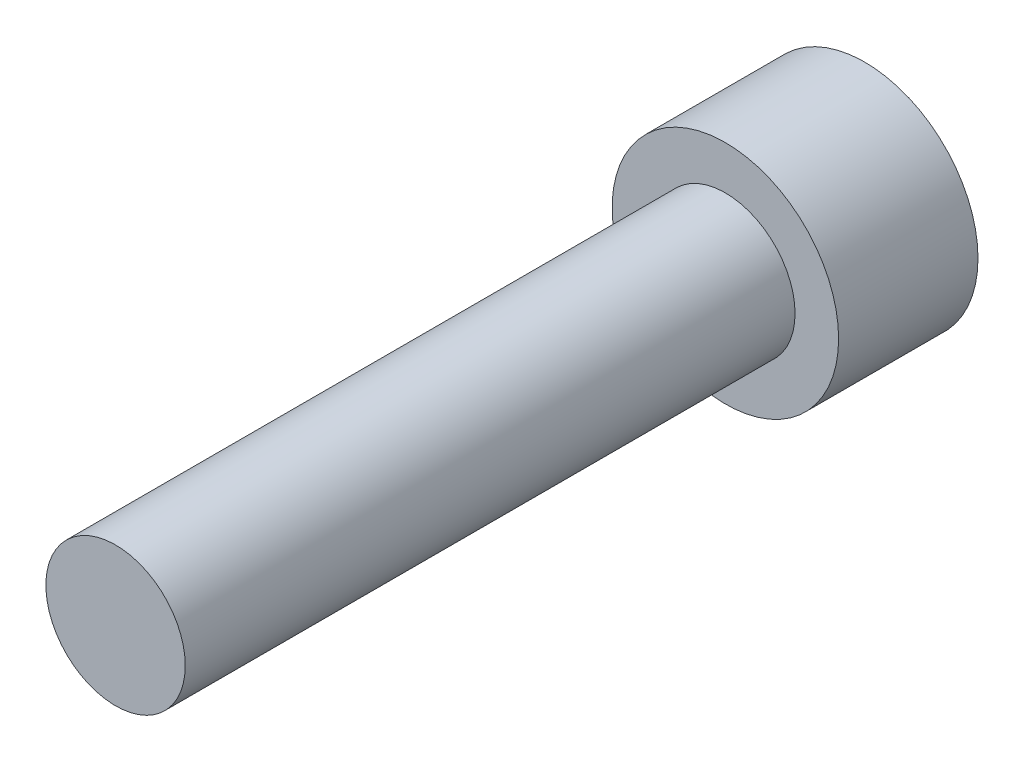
SolidWorks part; units mm, degrees
ref_plane "Front Plane" through (0, 0, 0) normal (0, 0, 1) x (1, 0, 0)
ref_plane "Top Plane" through (0, 0, 0) normal (0, 1, 0) x (1, 0, 0)
ref_plane "Right Plane" through (0, 0, 0) normal (1, 0, 0) x (0, 0, -1)
sketch "Sketch6" plane through (0, 0, 0) normal (1, 0, 0) x (0, 0, -1)
  line L0 (-35, 0) -> (22.525, 0) construction
  line L1 (7.15, 0) -> (-7.15, 0) construction
  line L2 (-35, 0) -> (-35, -4)
  line L3 (-35, -4) -> (0, -4)
  line L4 (0, 7.15) -> (0, -7.15) construction
  line L5 (0, -4) -> (0, -6.5)
  line L6 (0, -6.5) -> (8, -6.5)
  line L7 (8, -6.5) -> (8, 0)
  line L8 (8, 0) -> (-35, 0)
  dimension "L" = 35
  dimension "H" = 8
  dimension "A" = 13
  dimension "D" = 8
revolve "Revolve1" add sketch "Sketch6" angle 360 about L0
sketch "Sketch7" plane through (0, 0, -8) normal (0, 0, -1) x (-1, 0, 0)
  line L2 (-3, 1.7321) -> (-3, -1.7321)
  line L4 (-3, -1.7321) -> (0, -3.4641)
  line L5 (0, -3.4641) -> (3, -1.7321)
  line L6 (3, -1.7321) -> (3, 1.7321)
  line L7 (3, 1.7321) -> (0, 3.4641)
  line L8 (0, 3.4641) -> (-3, 1.7321)
  circle A0 centre (0, 0) radius 3 construction
  dimension "J" = 6
extrude "HEX" cut sketch "Sketch7" against normal blind 6
